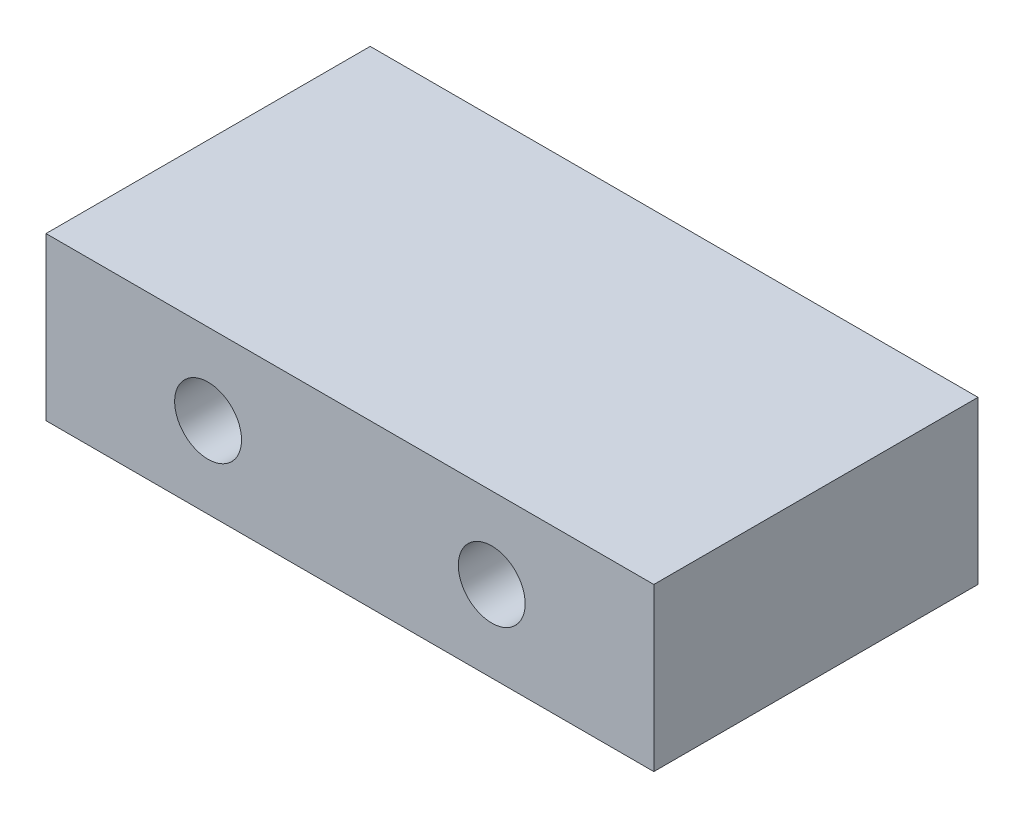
SolidWorks part; units mm, degrees
ref_plane "前视基准面" through (0, 0, 0) normal (0, 0, 1) x (1, 0, 0)
ref_plane "上视基准面" through (0, 0, 0) normal (0, 1, 0) x (1, 0, 0)
ref_plane "右视基准面" through (0, 0, 0) normal (1, 0, 0) x (0, 0, -1)
other "Configuration Table"
sketch "草图1" plane through (0, 0, 0) normal (0, 0, 1) x (1, 0, 0)
  line L1 (-15, 4) -> (15, 4)
  line L2 (-15, 4) -> (-15, -4)
  line L3 (-15, -4) -> (15, -4)
  line L4 (15, 4) -> (15, -4)
  line L5 (-15, 4) -> (15, -4) construction
  line L6 (-15, -4) -> (15, 4) construction
  point P0 (0, 0)
  dimension "D1" = 8
  dimension "D2" = 30
extrude "凸台-拉伸1" add sketch "草图1" along normal blind 16
hole_wizard "M4 螺纹孔1" positions "草图2" profile "草图3" tap size "M4" standard "GB"
sketch "草图2" plane through (0, 0, 16) normal (0, 0, 1) x (1, 0, 0)
  line L0 (-15, 4) -> (-15, -4) construction
  line L1 (15, -4) -> (15, 4) construction
  point P0 (-7, 0)
  point P2 (7, 0)
  dimension "D1" = 8
  dimension "D2" = 8
sketch "草图3" plane through (-7, 0, 16) normal (1, 0, 0) x (0, -1, 0)
  line L0 (0, 0) -> (0, 16)
  line L1 (0, 16) -> (1.65, 16)
  line L2 (1.65, 16) -> (1.65, 0)
  line L5 (1.65, 0) -> (0, 0)
  line L11 (0, -6.35) -> (0, 107.95) construction
  dimension "通孔螺纹孔钻头直径" = 3.3
  dimension "通孔螺纹孔钻头深度" = 16
